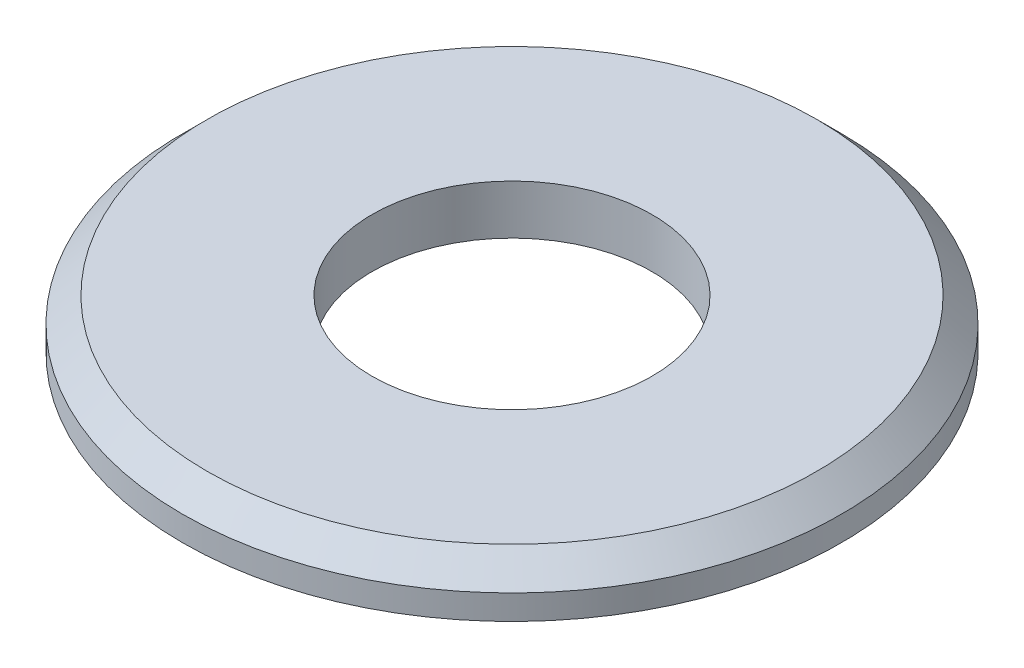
SolidWorks part; units mm, degrees
ref_plane "Front" through (0, 0, 0) normal (0, 0, 1) x (1, 0, 0)
ref_plane "Top" through (0, 0, 0) normal (0, 1, 0) x (1, 0, 0)
ref_plane "Right" through (0, 0, 0) normal (1, 0, 0) x (0, 0, -1)
sketch "Sketch1" plane through (0, 0, 0) normal (0, 1, 0) x (1, 0, 0)
  circle A0 centre (0, 0) radius 0.85
  circle A1 centre (0, 0) radius 2
extrude "Extrude1" add sketch "Sketch1" along normal blind 0.3
chamfer "Chamfer1" distance 0.15 1 edges at (0, 0.3, 2)
